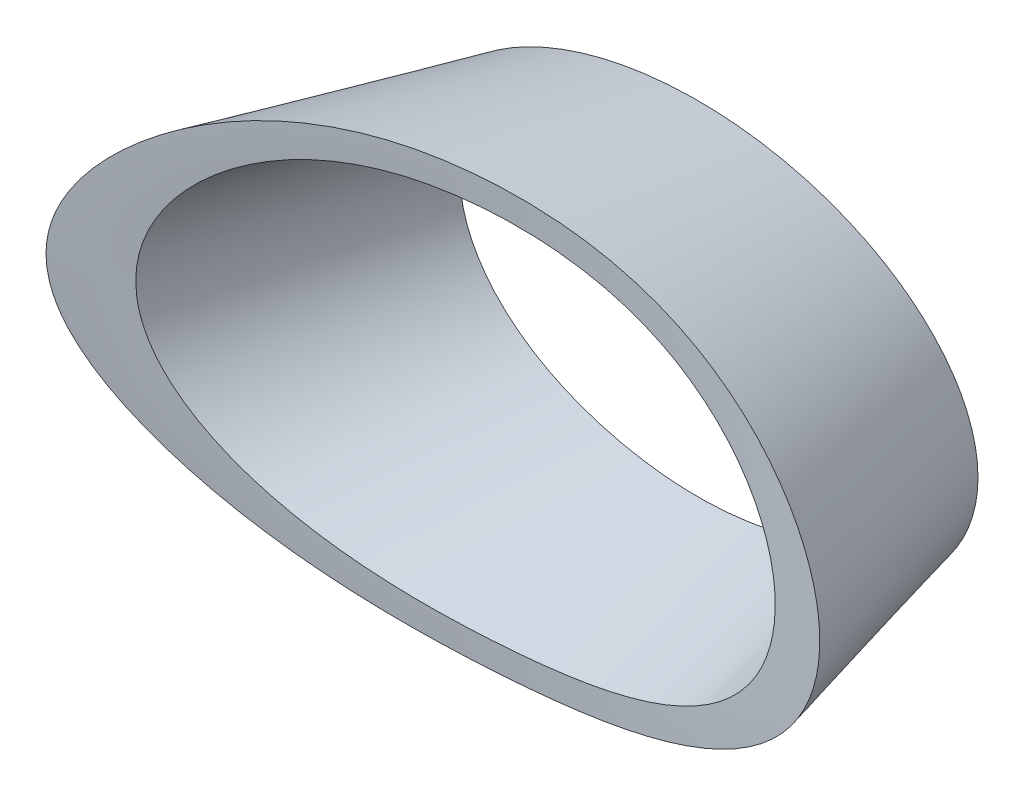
SolidWorks part; units mm, degrees
ref_plane "Ebene vorne" through (0, 0, 0) normal (0, 0, 1) x (1, 0, 0)
ref_plane "Ebene oben" through (0, 0, 0) normal (0, 1, 0) x (1, 0, 0)
ref_plane "Ebene rechts" through (0, 0, 0) normal (1, 0, 0) x (0, 0, -1)
sketch "Skizze1" plane through (0, 0, 0) normal (0, 0, 1) x (1, 0, 0)
  ellipse E0 centre (0, 0) end of major axis (50, 0) minor radius 33
  dimension "D1" = 100
  dimension "D2" = 66
sketch "Skizze7" plane through (0, 0, 0) normal (0, 0, 1) x (1, 0, 0)
  ellipse E0 centre (0, 0) end of major axis (58.8535, 0) minor radius 39.1697
sketch3d "3D-Skizze4"
  spline S1 degree 3 number of poles 112 (-46.2977, 28.391, 47.9602) -> (-46.2977, 28.391, 47.9602)
sketch3d "3D-Skizze7"
  spline S1 degree 3 number of poles 73 (-79.8588, 0, 57.2539) -> (-79.8588, 0, 57.2539)
sketch "Skizze10" plane through (0, 0, 0) normal (0, 1, 0) x (1, 0, 0)
  line L0 (-50, 0) -> (-65.4831, -52.7563)
  line L1 (50, 0) -> (60.7545, -44.5428)
  line L2 (-65.4831, -52.7563) -> (60.7545, -44.5428)
  line L3 (-50, 0) -> (50, 0)
sketch "Skizze11" plane through (0, 0, 0) normal (0, 1, 0) x (1, 0, 0)
  line L0 (-79.8588, -57.2539) -> (-58.8535, 0)
  line L1 (58.8535, 0) -> (72.0132, -46.4427)
  line L2 (-79.8588, -57.2539) -> (72.0132, -46.4427)
  line L3 (58.8535, 0) -> (-58.8535, 0)
sketch "Skizze13" plane through (0, 0, 0) normal (0, 1, 0) x (1, 0, 0)
  line L0 (-79.8588, -57.2539) -> (-65.4831, -52.7563)
  line L1 (-65.4831, -52.7563) -> (-50, 0)
  line L2 (-50, 0) -> (-58.8535, 0)
  line L3 (-58.8535, 0) -> (-79.8588, -57.2539)
loft "Ausformung2" add profiles "Skizze13"
